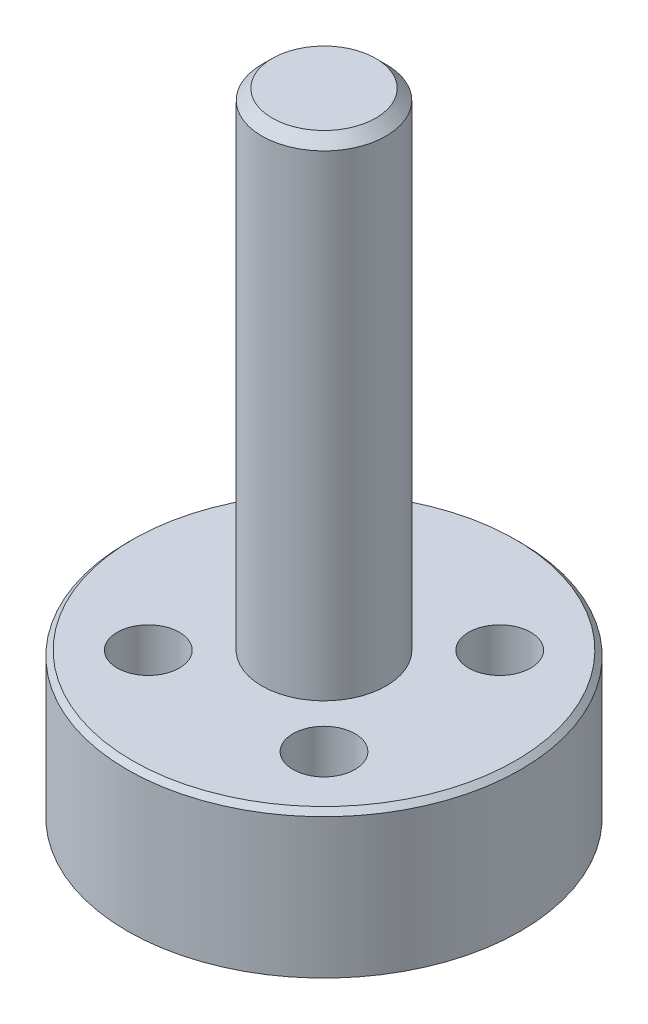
SolidWorks part; units mm, degrees
ref_plane "Front Plane" through (0, 0, 0) normal (0, 0, 1) x (1, 0, 0)
ref_plane "Top Plane" through (0, 0, 0) normal (0, 1, 0) x (1, 0, 0)
ref_plane "Right Plane" through (0, 0, 0) normal (1, 0, 0) x (0, 0, -1)
sketch "Sketch1" plane through (0, 0, 0) normal (0, 1, 0) x (1, 0, 0)
  line L1 (-4.2426, -4.2426) -> (4.2426, -4.2426) construction
  line L2 (-4.2426, -4.2426) -> (-4.2426, 4.2426) construction
  line L3 (-4.2426, 4.2426) -> (4.2426, 4.2426) construction
  line L4 (4.2426, -4.2426) -> (4.2426, 4.2426) construction
  line L5 (-4.2426, -4.2426) -> (4.2426, 4.2426) construction
  line L6 (-4.2426, 4.2426) -> (4.2426, -4.2426) construction
  circle A0 centre (0, 0) radius 9.5
  circle A1 centre (0, 0) radius 6 construction
  circle A2 centre (4.2426, 4.2426) radius 1.5
  circle A3 centre (-4.2426, 4.2426) radius 1.5
  circle A4 centre (-4.2426, -4.2426) radius 1.5
  circle A5 centre (4.2426, -4.2426) radius 1.5
  dimension "D1" = 19
  dimension "D2" = 12
  dimension "D3" = 3
extrude "Boss-Extrude1" add sketch "Sketch1" along normal blind 7
sketch "Sketch2" plane through (0, 7, 0) normal (0, 1, 0) x (1, 0, 0)
  circle A0 centre (0, 0) radius 3
  dimension "D1" = 6
extrude "Boss-Extrude2" add sketch "Sketch2" along normal blind 23.5
chamfer "Chamfer1" distance 0.5 angle 45 1 edges at (0, 30.5, 3)
chamfer "Chamfer2" distance 0.25 angle 45 1 edges at (0, 7, 9.5)
sketch "Sketch3" plane through (0, 0, 0) normal (0, -1, 0) x (1, 0, 0)
  circle A0 centre (0, 0) radius 2.5
  dimension "D1" = 5
extrude "Cut-Extrude1" cut sketch "Sketch3" against normal blind 5
